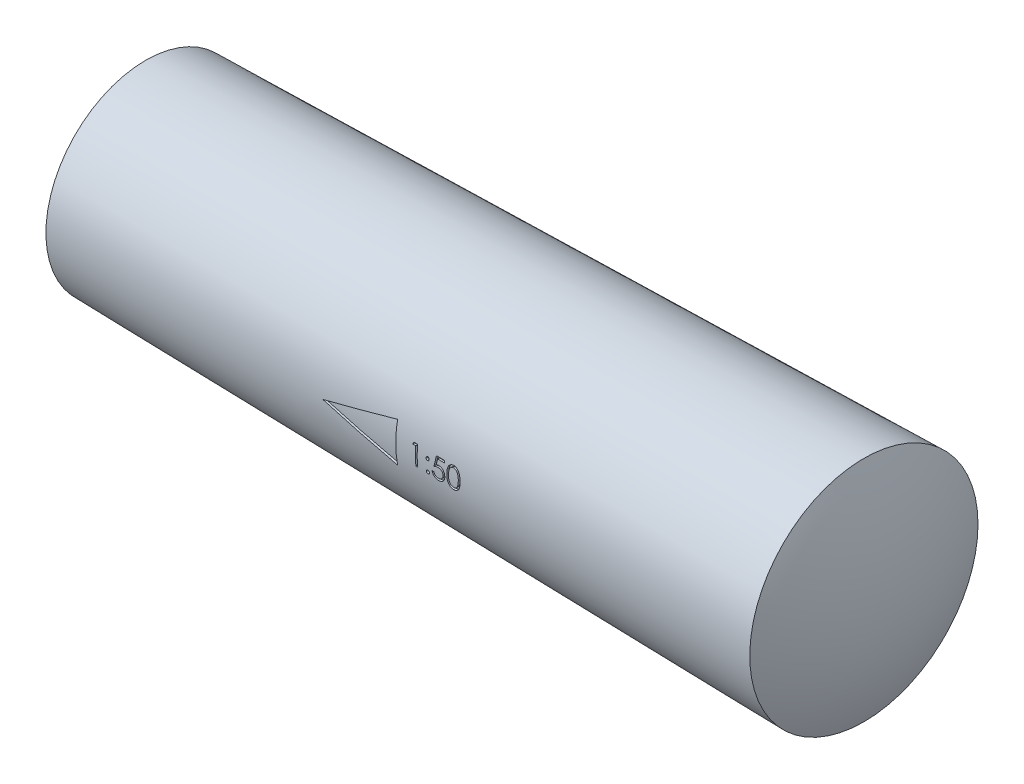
SolidWorks part; units mm, degrees
ref_plane "Front Plane" through (0, 0, 0) normal (0, 0, 1) x (1, 0, 0)
ref_plane "Top Plane" through (0, 0, 0) normal (0, 1, 0) x (1, 0, 0)
ref_plane "Right Plane" through (0, 0, 0) normal (1, 0, 0) x (0, 0, -1)
sketch "Sketch1" plane through (0, 0, 0) normal (1, 0, 0) x (0, 0, -1)
  circle A0 centre (0, 0) radius 5
  dimension "D1" = 10
extrude "Extrude1" add sketch "Sketch1" along normal mid plane 36
draft "Draft1" type of draft neutral plane draft angle 1.146 faces to draft 1 parameters "D1"=1.146
sketch "Sketch2" plane through (0, 0, 0) normal (0, 0, 1) x (1, 0, 0)
  line L0 (-18, 0) -> (-18, 5)
  line L1 (-18, 5) -> (-18, -5) construction
  line L2 (-18, 0) -> (-19.2, 0)
  line L3 (-19.2, 0) -> (-19.2, -5.36) construction
  line L4 (18, 0) -> (18, 5.72)
  line L5 (18, -5.72) -> (18, 5.72) construction
  line L6 (18, 0) -> (19.2, 0)
  line L7 (19.2, 0) -> (19.2, -5.36) construction
  line L8 (-18, -5) -> (18, -5.72) construction
  arc A0 (-19.2, 0) -> (-18, 5) centre (-8.1833, 0) cw
  arc A1 (19.2, 0) -> (18, 5.72) centre (4.9672, 0) ccw
  point P14 (0, -5.36)
revolve "Revolve1" add sketch "Sketch2" angle 360 about L2
sketch "Sketch5" plane through (0, 0, 0) normal (0, 0, 1) x (1, 0, 0)
  line L0 (0, 5.36) -> (0, -5.36) construction
  line L1 (18, 5.72) -> (-18, 5) construction
  line L2 (-18, -5) -> (18, -5.72) construction
ref_plane "Plane2" through (0, 0, 0) normal (-0.02, 0, 0.9998) x (0.9998, 0, 0.02)
sketch "Sketch6" plane through (0, 0, 0) normal (-0.02, 0, 0.9998) x (0.9998, 0, 0.02)
  line L0 (0, 0) -> (0, 1)
  line L1 (0, 5.36) -> (0, -5.36) construction
  line L2 (0, 1) -> (-3.7321, 0)
  line L3 (-3.7321, 0) -> (0, -1)
  line L4 (0, -1) -> (0, 0)
  line L5 (0, -0.5) -> (4, -0.5) construction
  text T0 "1:50" font "Century Gothic" height 1
  dimension "D1" = 2
  dimension "D2" = 30
  dimension "D3" = 4
wrap "Wrap2" sketch "Sketch6" wrap type deboss source sketch "Sketch6" thickness 0.1 parameters "D1"=0.1
equation "\"D2@Sketch2\" = \"D1@Sketch2\""
